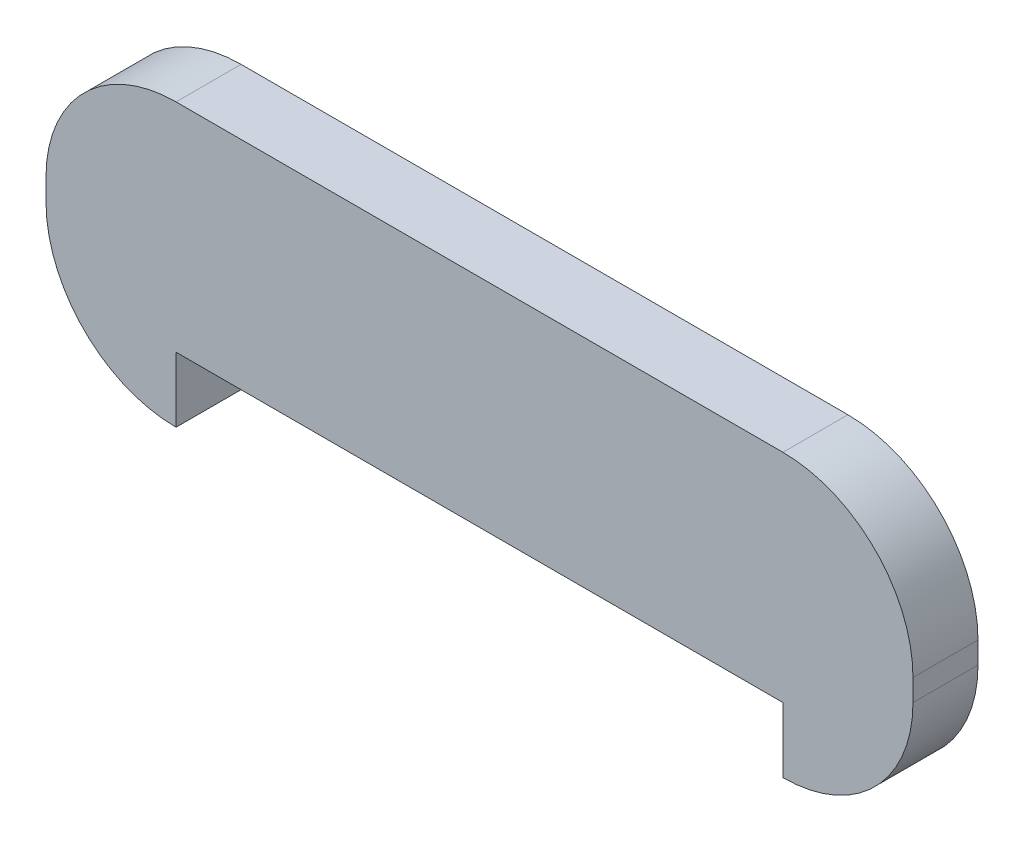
SolidWorks part; units mm, degrees
ref_plane "Plan de face" through (0, 0, 0) normal (0, 0, 1) x (1, 0, 0)
ref_plane "Plan de dessus" through (0, 0, 0) normal (0, 1, 0) x (1, 0, 0)
ref_plane "Plan de droite" through (0, 0, 0) normal (1, 0, 0) x (0, 0, -1)
sketch "Esquisse1" plane through (0, 0, 0) normal (0, 0, 1) x (1, 0, 0)
  line L0 (-48.1968, 0) -> (-48.1968, 3)
  line L1 (-48.1968, 3) -> (-20.1968, 3)
  line L2 (-54.1968, 6) -> (-54.1968, 7)
  line L3 (-48.1968, 13) -> (-20.1968, 13)
  line L4 (-14.1968, 6) -> (-14.1968, 7)
  line L5 (-20.1968, 3) -> (-20.1968, 0)
  arc A0 (-48.1968, 0) -> (-54.1968, 6) centre (-48.1968, 6) cw
  arc A1 (-54.1968, 7) -> (-48.1968, 13) centre (-48.1968, 7) cw
  arc A2 (-20.1968, 0) -> (-14.1968, 6) centre (-20.1968, 6) ccw
  arc A3 (-20.1968, 13) -> (-14.1968, 7) centre (-20.1968, 7) cw
  point P5 (-48.1968, 7)
  point P8 (-20.1968, 6)
  point P12 (-20.1968, 7)
extrude "Boss.-Extru.1" add sketch "Esquisse1" along normal blind 3
